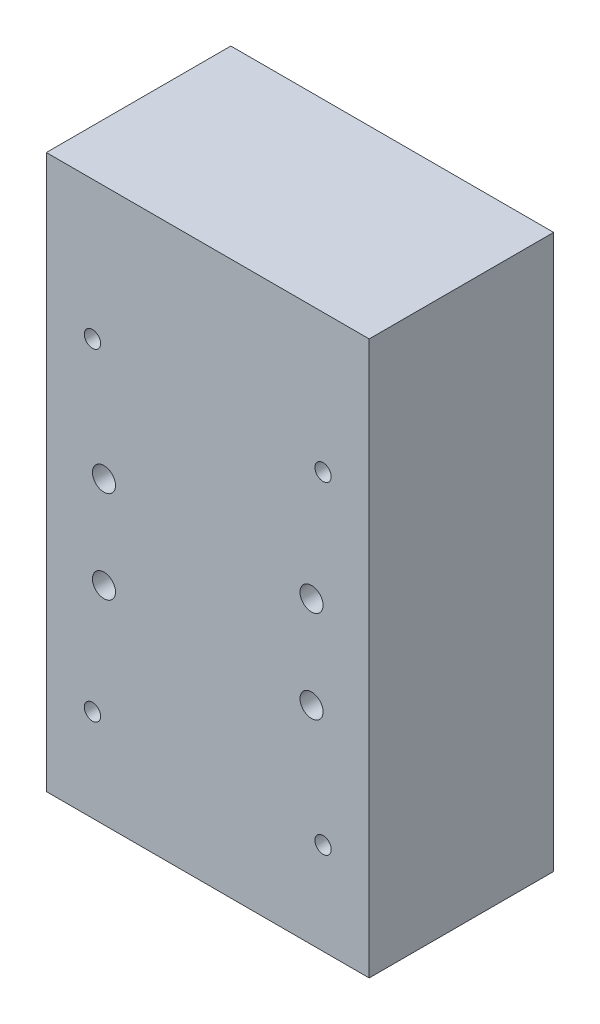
SolidWorks part; units mm, degrees
ref_plane "Front Plane" through (0, 0, 0) normal (0, 0, 1) x (1, 0, 0)
ref_plane "Top Plane" through (0, 0, 0) normal (0, 1, 0) x (1, 0, 0)
ref_plane "Right Plane" through (0, 0, 0) normal (1, 0, 0) x (0, 0, -1)
sketch "Sketch1" plane through (0, 0, 0) normal (0, 1, 0) x (1, 0, 0)
  line L1 (-44.45, 25.4) -> (44.45, 25.4)
  line L2 (-44.45, 25.4) -> (-44.45, -25.4)
  line L3 (-44.45, -25.4) -> (44.45, -25.4)
  line L4 (44.45, 25.4) -> (44.45, -25.4)
  line L5 (-44.45, 25.4) -> (44.45, -25.4) construction
  line L6 (-44.45, -25.4) -> (44.45, 25.4) construction
  point P0 (0, 0)
  dimension "D1" = 88.9
  dimension "D2" = 50.8
extrude "Boss-Extrude1" add sketch "Sketch1" along normal blind 152.4
hole_wizard "CSK for #8 Flat Head Machine Screw (100)1" positions "Sketch3" profile "Sketch2" countersink size "#8" standard "ANSI Inch"
sketch "Sketch3" plane through (0, 0, -25.4) normal (0, 0, -1) x (-1, 0, 0)
  line L0 (-44.45, 152.4) -> (-44.45, 0) construction
  line L1 (44.45, 152.4) -> (44.45, 0) construction
  line L2 (-44.45, 0) -> (44.45, 0) construction
  point P0 (-31.75, 114.3)
  point P2 (31.75, 114.3)
  point P4 (-31.75, 25.4)
  point P6 (31.75, 25.4)
  dimension "D1" = 12.7
  dimension "D2" = 12.7
  dimension "D3" = 12.7
  dimension "D4" = 12.7
  dimension "D5" = 25.4
  dimension "D6" = 25.4
  dimension "D7" = 114.3
  dimension "D8" = 114.3
sketch "Sketch2" plane through (31.75, 114.3, -25.4) normal (1, 0, 0) x (0, 1, 0)
  line L0 (0, 0) -> (0, 50.8)
  line L1 (0, 50.8) -> (2.2479, 50.8)
  line L2 (2.2479, 50.8) -> (2.2479, 1.6518)
  line L3 (2.2479, 1.6518) -> (4.2164, 0)
  line L5 (4.2164, 0) -> (0, 0)
  line L6 (-2.2479, 1.6518) -> (-4.2164, 0) construction
  line L11 (0, -6.35) -> (0, 107.95) construction
  dimension "Thru Hole Dia." = 4.4958
  dimension "Thru Hole Depth" = 50.8
  dimension "Near C'Sink Dia." = 8.4328
  dimension "Near C'Sink Angle" = 100
sketch "Sketch4" plane through (0, 69.8094, -25.4) normal (0, 0, 1) x (-1, 0, 0)
  line L0 (-38.1, 22.225) -> (38.1, -22.225) construction
  line L1 (-34.1376, 22.225) -> (34.1376, 22.225)
  line L2 (-38.1, 18.2626) -> (-38.1, -18.2626)
  line L3 (-34.1376, -22.225) -> (34.1376, -22.225)
  line L4 (38.1, 18.2626) -> (38.1, -18.2626)
  line L5 (44.45, -82.5906) -> (44.45, 69.8094) construction
  line L8 (0, 0) -> (0, 22.225) construction
  line L9 (0, 0) -> (38.1, 0) construction
  circle A0 centre (-28.575, 12.7) radius 3.175
  circle A1 centre (-28.575, -12.7) radius 3.175
  circle A2 centre (28.575, -12.7) radius 3.175
  circle A3 centre (28.575, 12.7) radius 3.175
  arc A4 (-38.1, -18.2626) -> (-34.1376, -22.225) centre (-34.1376, -18.2626) ccw
  arc A5 (34.1376, -22.225) -> (38.1, -18.2626) centre (34.1376, -18.2626) ccw
  arc A6 (34.1376, 22.225) -> (38.1, 18.2626) centre (34.1376, 18.2626) cw
  arc A7 (-34.1376, 22.225) -> (-38.1, 18.2626) centre (-34.1376, 18.2626) ccw
  point P24 (38.1, 22.225)
  dimension "D1" = 6.35
extrude "Cut-Extrude1" cut sketch "Sketch4" along normal through all
